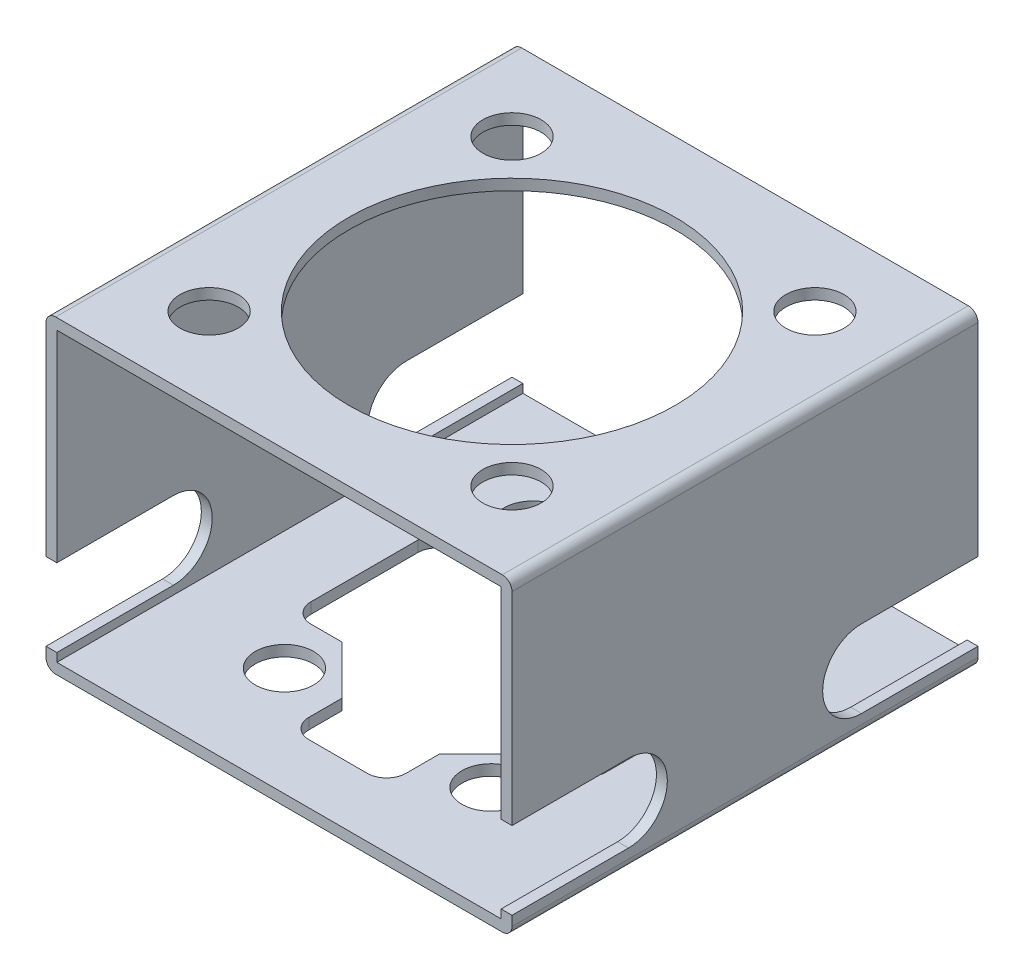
SolidWorks part; units mm, degrees
ref_plane "Front Plane" through (0, 0, 0) normal (0, 0, 1) x (1, 0, 0)
ref_plane "Top Plane" through (0, 0, 0) normal (0, 1, 0) x (1, 0, 0)
ref_plane "Right Plane" through (0, 0, 0) normal (1, 0, 0) x (0, 0, -1)
sketch "Sketch1" plane through (0, 0, 0) normal (0, 0, 1) x (1, 0, 0)
  line L0 (1.778, 1.778) -> (74.422, 1.778)
  line L1 (1.5875, 0) -> (74.6125, 0)
  line L2 (0, 1.5875) -> (0, 49.0093)
  line L3 (1.5875, 50.5968) -> (74.6125, 50.5968)
  line L4 (76.2, 1.5875) -> (76.2, 49.0093)
  line L5 (74.422, 1.778) -> (74.422, 48.8188)
  line L6 (1.778, 48.8188) -> (74.422, 48.8188)
  line L7 (1.778, 1.778) -> (1.778, 48.8188)
  arc A0 (1.5875, 50.5968) -> (0, 49.0093) centre (1.5875, 49.0093) ccw
  arc A1 (76.2, 49.0093) -> (74.6125, 50.5968) centre (74.6125, 49.0093) ccw
  arc A2 (74.6125, 0) -> (76.2, 1.5875) centre (74.6125, 1.5875) ccw
  arc A3 (1.5875, 0) -> (0, 1.5875) centre (1.5875, 1.5875) cw
  arc A4 (74.422, 1.778) -> (74.422, 1.778) centre (74.422, 1.778) ccw
  arc A5 (74.422, 48.8188) -> (74.422, 48.8188) centre (74.422, 48.8188) ccw
  arc A6 (1.778, 48.8188) -> (1.778, 48.8188) centre (1.778, 48.8188) ccw
  arc A7 (1.778, 1.778) -> (1.778, 1.778) centre (1.778, 1.778) cw
  point P6 (0, 50.5968)
  point P11 (76.2, 0)
  point P14 (0, 0)
  dimension "D3" = 1.5875
  dimension "D1" = 50.5968
  dimension "D2" = 76.2
  dimension "D4" = 1.778
extrude "Extrude1" add sketch "Sketch1" against normal mid plane 76.2
sketch "Sketch2" plane through (0, 0, 0) normal (1, 0, 0) x (0, 0, -1)
  line L0 (-38.1, 15.875) -> (-19.05, 15.875)
  line L2 (-19.05, 3.175) -> (-38.1, 3.175)
  line L3 (-47.7856, 9.525) -> (-8.2461, 9.525) construction
  line L4 (38.1, 0) -> (-38.1, 0) construction
  line L5 (-38.1, 1.5875) -> (-38.1, 49.0093) construction
  line L6 (-38.1, 3.175) -> (-38.1, 15.875)
  arc A0 (-19.05, 3.175) -> (-19.05, 15.875) centre (-19.05, 9.525) ccw
  dimension "D2" = 6.35
  dimension "D3" = 19.05
  dimension "D1" = 9.525
extrude "Cut-Extrude4" cut sketch "Sketch2" along normal through all
mirror "Mirror1" about plane through (0, 0, 0) normal (0, 0, 1) of "Cut-Extrude4"
sketch "Sketch3" plane through (0, 50.5968, 0) normal (0, 1, 0) x (-1, 0, 0)
  line L0 (-38.1, 38.1) -> (-38.1, -38.1) construction
  line L1 (-74.6125, 38.1) -> (-1.5875, 38.1) construction
  line L2 (-74.6125, -38.1) -> (-1.5875, -38.1) construction
  line L3 (0, 0) -> (-76.2, 0) construction
  line L4 (0, -38.1) -> (0, 38.1) construction
  line L5 (-76.2, -38.1) -> (-76.2, 38.1) construction
  circle A0 centre (-38.1, 0) radius 26.67
  circle A1 centre (-13.335, -24.765) radius 4.7625
  circle A2 centre (-62.865, -24.765) radius 4.7625
  circle A3 centre (-62.865, 24.765) radius 4.7625
  circle A4 centre (-13.335, 24.765) radius 4.7625
  dimension "D1" = 53.34
  dimension "D2" = 9.525
  dimension "D3" = 49.53
  dimension "D4" = 49.53
extrude "Cut-Extrude5" cut sketch "Sketch3" against normal blind 1.778
sketch "Sketch4" plane through (0, 0, 0) normal (0, -1, 0) x (1, 0, 0)
  line L0 (38.1, 38.1) -> (38.1, -38.1) construction
  line L3 (1.5875, 38.1) -> (74.6125, 38.1) construction
  line L4 (1.5875, -38.1) -> (74.6125, -38.1) construction
  line L5 (0, 0) -> (76.2, 0) construction
  line L6 (0, -38.1) -> (0, 38.1) construction
  line L7 (76.2, -38.1) -> (76.2, 38.1) construction
  circle A0 centre (21.209, 20.32) radius 4.7625
  circle A1 centre (54.991, 20.32) radius 4.7625
  circle A2 centre (54.991, -20.32) radius 4.7625
  circle A3 centre (21.209, -20.32) radius 4.7625
  dimension "D3" = 9.525
  dimension "D1" = 33.782
  dimension "D2" = 40.64
extrude "Cut-Extrude6" cut sketch "Sketch4" against normal blind 1.778
sketch "Sketch5" plane through (0, 0, 0) normal (0, -1, 0) x (1, 0, 0)
  line L0 (38.1, 38.1) -> (38.1, -38.1) construction
  line L1 (1.5875, 38.1) -> (74.6125, 38.1) construction
  line L2 (1.5875, -38.1) -> (74.6125, -38.1) construction
  line L3 (0, 0) -> (76.2, 0) construction
  line L4 (0, -38.1) -> (0, 38.1) construction
  line L5 (76.2, -38.1) -> (76.2, 38.1) construction
  line L6 (13.97, 11.9062) -> (22.225, 11.9062)
  line L7 (30.1625, 28.4353) -> (46.0375, 28.4353)
  line L8 (30.1625, -28.4353) -> (46.0375, -28.4353)
  line L9 (30.1625, 28.4353) -> (30.1625, 19.8437)
  line L10 (13.97, 11.9062) -> (13.97, -11.9062)
  line L11 (62.23, 11.9062) -> (62.23, -11.9062)
  line L12 (30.1625, 19.8437) -> (22.225, 11.9062)
  line L13 (46.0375, 28.4353) -> (46.0375, 19.8437)
  line L14 (46.0375, 19.8437) -> (53.975, 11.9062)
  line L15 (62.23, 11.9062) -> (53.975, 11.9062)
  line L16 (62.23, -11.9062) -> (53.975, -11.9062)
  line L17 (46.0375, -19.8437) -> (53.975, -11.9062)
  line L18 (46.0375, -28.4353) -> (46.0375, -19.8437)
  line L19 (30.1625, -28.4353) -> (30.1625, -19.8437)
  line L20 (13.97, -11.9062) -> (22.225, -11.9062)
  line L21 (30.1625, -19.8437) -> (22.225, -11.9062)
  circle A0 centre (38.1, 0) radius 28.575 construction
  point P16 (38.1, 28.4353)
  point P22 (13.97, 0)
  dimension "D1" = 57.15
  dimension "D2" = 56.8706
  dimension "D3" = 15.875
  dimension "D4" = 23.8125
  dimension "D5" = 48.26
  dimension "D6" = 45
  dimension "D7" = 7.9375
extrude "Cut-Extrude7" cut sketch "Sketch5" against normal blind 1.778
fillet "Fillet1" radius 3.175 8 edges at (62.23, 0.889, -11.9062) (46.0375, 0.889, -28.4353) (62.23, 0.889, 11.9062) (46.0375, 0.889, 28.4353) (30.1625, 0.889, -28.4353) (13.97, 0.889, -11.9062) (13.97, 0.889, 11.9062) (30.1625, 0.889, 28.4353)
